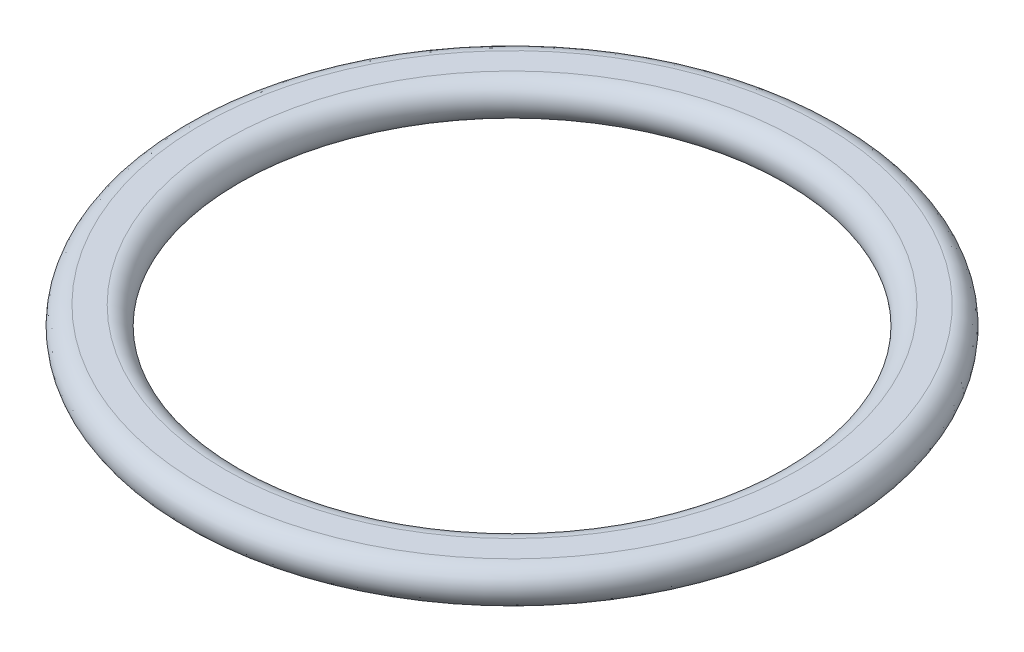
SolidWorks part; units mm, degrees
ref_plane "Plan de face" through (0, 0, 0) normal (0, 0, 1) x (1, 0, 0)
ref_plane "Plan de dessus" through (0, 0, 0) normal (0, 1, 0) x (1, 0, 0)
ref_plane "Plan de droite" through (0, 0, 0) normal (1, 0, 0) x (0, 0, -1)
sketch "Esquisse1" plane through (0, 0, 0) normal (0, 0, 1) x (1, 0, 0)
  line L0 (29.65, -1.9) -> (32.23, -1.9)
  line L1 (32.23, 1.9) -> (29.65, 1.9)
  line L2 (0, 2.0071) -> (0, -2.0071) construction
  arc A0 (29.65, 1.9) -> (29.65, -1.9) centre (29.65, 0) ccw
  spline S0 degree 3 poles (32.23, 1.9) (32.4427, 1.9) (32.6582, 1.8633) (32.8589, 1.7929) (33.0596, 1.7225) (33.2509, 1.6165) (33.4169, 1.4837) (33.583, 1.3508) (33.7284, 1.1875) (33.8411, 1.0071) (33.9538, 0.8268) (34.037, 0.6246) (34.0837, 0.4171) (34.1303, 0.2096) (34.1418, -0.0088) (34.1172, -0.22) (34.0926, -0.4312) (34.0312, -0.6411) (33.938, -0.8323) (33.8449, -1.0234) (33.7174, -1.2012) (33.5662, -1.3507) (33.4151, -1.5003) (33.236, -1.6258) (33.0438, -1.7169) (32.8517, -1.808) (32.6411, -1.8671) (32.4296, -1.8895) (32.3634, -1.8965) (32.2966, -1.9) (32.23, -1.9) knots 0 0 0 0 0.000638 0.000638 0.000638 0.001276 0.001276 0.001276 0.001914 0.001914 0.001914 0.002552 0.002552 0.002552 0.00319 0.00319 0.00319 0.003828 0.003828 0.003828 0.004466 0.004466 0.004466 0.005104 0.005104 0.005104 0.005742 0.005742 0.005742 0.005939 0.005939 0.005939 0.005939
revolve "Révolution1" add sketch "Esquisse1" angle 360 about L2
